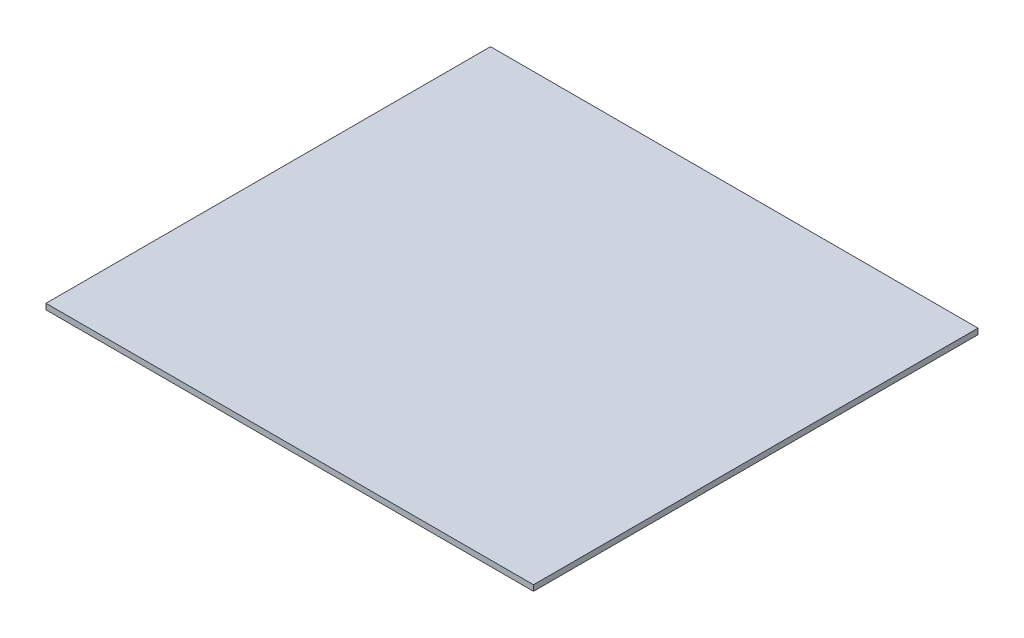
SolidWorks part; units mm, degrees
ref_plane "Front Plane" through (0, 0, 0) normal (0, 0, 1) x (1, 0, 0)
ref_plane "Top Plane" through (0, 0, 0) normal (0, 1, 0) x (1, 0, 0)
ref_plane "Right Plane" through (0, 0, 0) normal (1, 0, 0) x (0, 0, -1)
sketch "Sketch2" plane through (0, 0, 0) normal (0, 1, 0) x (1, 0, 0)
  line L1 (-108.0721, -98.5395) -> (108.0721, -98.5395)
  line L2 (-108.0721, -98.5395) -> (-108.0721, 98.5395)
  line L3 (-108.0721, 98.5395) -> (108.0721, 98.5395)
  line L4 (108.0721, -98.5395) -> (108.0721, 98.5395)
  line L5 (-108.0721, -98.5395) -> (108.0721, 98.5395) construction
  line L6 (-108.0721, 98.5395) -> (108.0721, -98.5395) construction
  point P0 (0, 0)
  point P6 (108.0721, 98.5395)
extrude "Boss-Extrude2" add sketch "Sketch2" along normal blind 2.54
